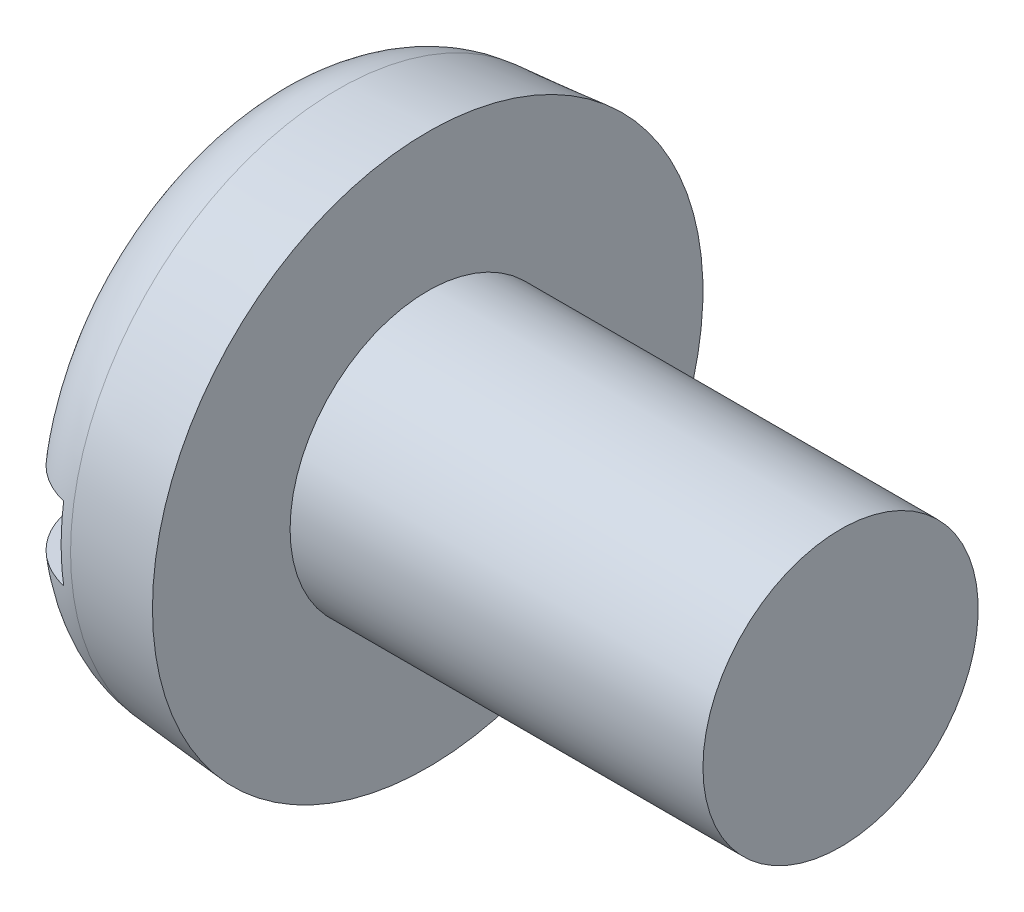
SolidWorks part; units mm, degrees
ref_plane "Plane1" through (0, 0, 0) normal (0, 0, 1) x (1, 0, 0)
ref_plane "Plane2" through (0, 0, 0) normal (0, 1, 0) x (1, 0, 0)
ref_plane "Plane3" through (0, 0, 0) normal (1, 0, 0) x (0, 0, -1)
sketch "BodySke" plane through (0, 0, 0) normal (0, 0, 1) x (1, 0, 0)
  line L0 (3.6, 3) -> (3.6, 6)
  line L1 (0, 0) -> (0, 5.685)
  line L2 (-25.4, 0) -> (127, 0) construction
  line L3 (12.6, 0) -> (0, 0)
  line L4 (3.6, 3) -> (12.6, 3)
  line L5 (12.6, 3) -> (12.6, 0)
  line L6 (0, 5.685) -> (3.6, 6)
  line L9 (4.6, 4.5875) -> (4.6, -4.9375) construction
  line L10 (3.6, 6.35) -> (3.6, -3.175) construction
  dimension "Head_ht" = 3.6
  dimension "Diameter" = 6
  dimension "Length" = 9
  dimension "Head_dia" = 12
  dimension "Advance" = 1
  dimension "Thread_nom" = 9
  dimension "Head_side_angle" = 5
revolve "Base-Revolve" add sketch "BodySke"
fillet "Fillet1" [suppressed] radius 0.25
fillet "Fillet2" radius 1.8 1 edges at (0, 0, 5.685)
sketch "Sketch2" plane through (0, 0, 0) normal (1, 0, 0) x (0, 0, -1)
  line L0 (6, -0.8) -> (-6, -0.8)
  line L1 (6, -0.8) -> (6, 0.8)
  line L2 (-6, 0.8) -> (6, 0.8)
  line L3 (-6, 0.8) -> (-6, -0.8)
  dimension "D1" = 12
  dimension "D2" = 6
  dimension "Slot_width" = 1.6
  dimension "D3" = 0.8
extrude "Slot" cut sketch "Sketch2" along normal blind 1.4
sketch "ThdSchSke" plane through (0, 0, 0) normal (0, 0, 1) x (1, 0, 0)
  line L0 (5.6, -2.4455) -> (5.2117, -3)
  line L1 (5.6, -2.4455) -> (5.9883, -3)
  line L2 (5.9883, -3) -> (5.9883, -3.75)
  line L3 (-3.175, 0) -> (5.1513, 0) construction
  line L5 (5.9883, -3.75) -> (5.2117, -3.75)
  line L6 (5.2117, -3.75) -> (5.2117, -3)
  dimension "Thread_minor" = 4.891
  dimension "Diameter" = 6
  dimension "Start" = 5.6
  dimension "SideAngle" = 55
  dimension "VeeAngle" = 70
  dimension "Overcut" = 7.5
revolve "ThreadSchematic" [suppressed] cut sketch "ThdSchSke" angle 360 about L3
pattern_linear "ThdSchPat" [suppressed]
equation "\"D1@Sketch2\" = \"Head_dia@BodySke\""
equation "\"D2@Sketch2\" = \"D1@Sketch2\" / 2"
equation "\"D3@Sketch2\" = \"Slot_width@Sketch2\" / 2"
equation "\"Thread_length@ThreadCosmetic\" = ((sgn( (\"Length@BodySke\" - \"Advance@BodySke\" * 2.0 ) - \"Thread_nom@BodySke\" )-1)*( (\"Length@BodySke\" - \"Advance@BodySke\"  * 2.0) - \"Thread_nom@BodySke\" ))/-2+ \"Thread_"
equation "\"Thread_minor@ThdSchSke\" = \"Thread_minor@ThreadCosmetic\""
equation "\"Diameter@ThdSchSke\" = \"Diameter@BodySke\""
equation "\"Overcut@ThdSchSke\" = \"Diameter@BodySke\" * 1.25"
equation "\"Start@ThdSchSke\" = \"Head_ht@BodySke\" + \"Length@BodySke\" - \"Thread_length@ThreadCosmetic\"  '---Non-countersunk---"
equation "\"Num_threads@ThdSchPat\" = int( \"Thread_length@ThreadCosmetic\" / \"Advance@BodySke\" + 0.999 )  + 1"
equation "\"Advance@ThdSchPat\" = \"Thread_length@ThreadCosmetic\" /  (\"Num_threads@ThdSchPat\" - 1) 'relax it"
